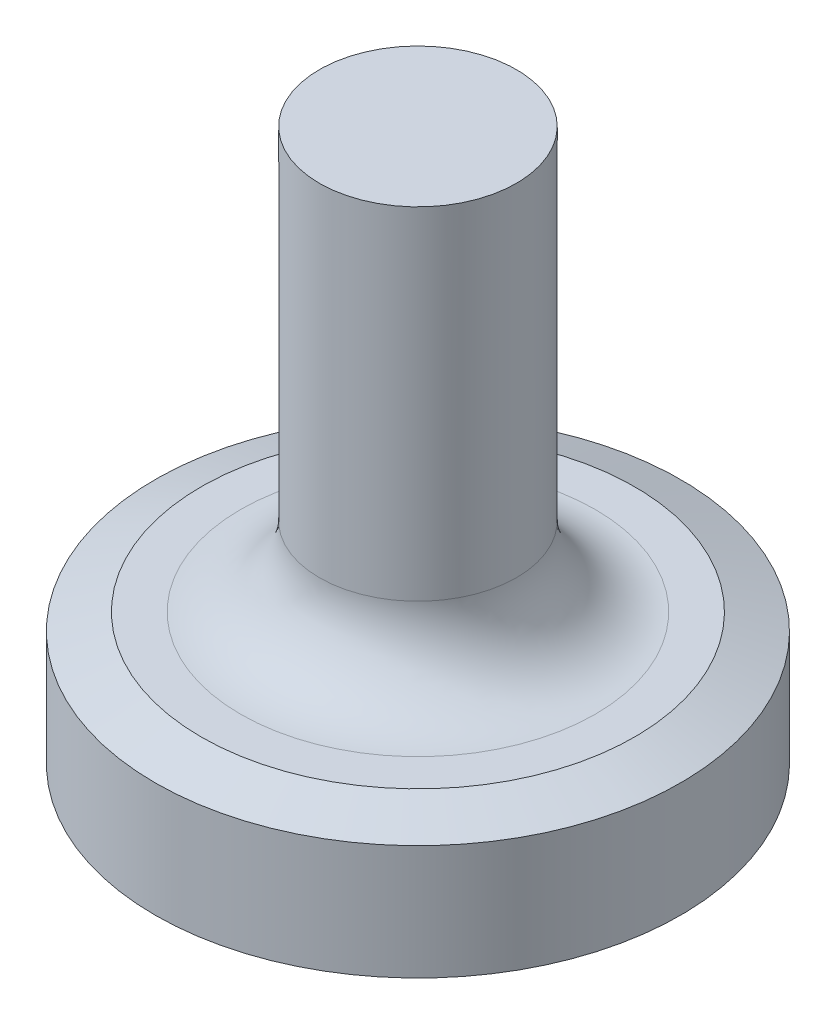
SolidWorks part; units mm, degrees
ref_plane "前视基准面" through (0, 0, 0) normal (0, 0, 1) x (1, 0, 0)
ref_plane "上视基准面" through (0, 0, 0) normal (0, 1, 0) x (1, 0, 0)
ref_plane "右视基准面" through (0, 0, 0) normal (1, 0, 0) x (0, 0, -1)
sketch "草图1" plane through (0, 0, 0) normal (1, 0, 0) x (0, 0, -1)
  line L0 (0, 124.8966) -> (0, -145.5515) construction
  line L1 (0, 210) -> (37.5, 210)
  line L2 (37.5, 210) -> (37.5, 50)
  line L3 (37.5, 50) -> (82.5, 50)
  line L4 (82.5, 50) -> (100, 43.6305)
  line L5 (100, 43.6305) -> (100, 0)
  line L6 (100, 0) -> (0, 0)
  line L7 (0, 0) -> (0, 210)
  point P3 (0, 0)
  dimension "D1" = 210
  dimension "D2" = 75
  dimension "D3" = 165
  dimension "200" = 200
  dimension "D5" = 160
  dimension "D6" = 50
revolve "旋转1" add sketch "草图1" angle 360 about L0
fillet "圆角1" radius 30 1 edges at (0, 50, 37.5)
